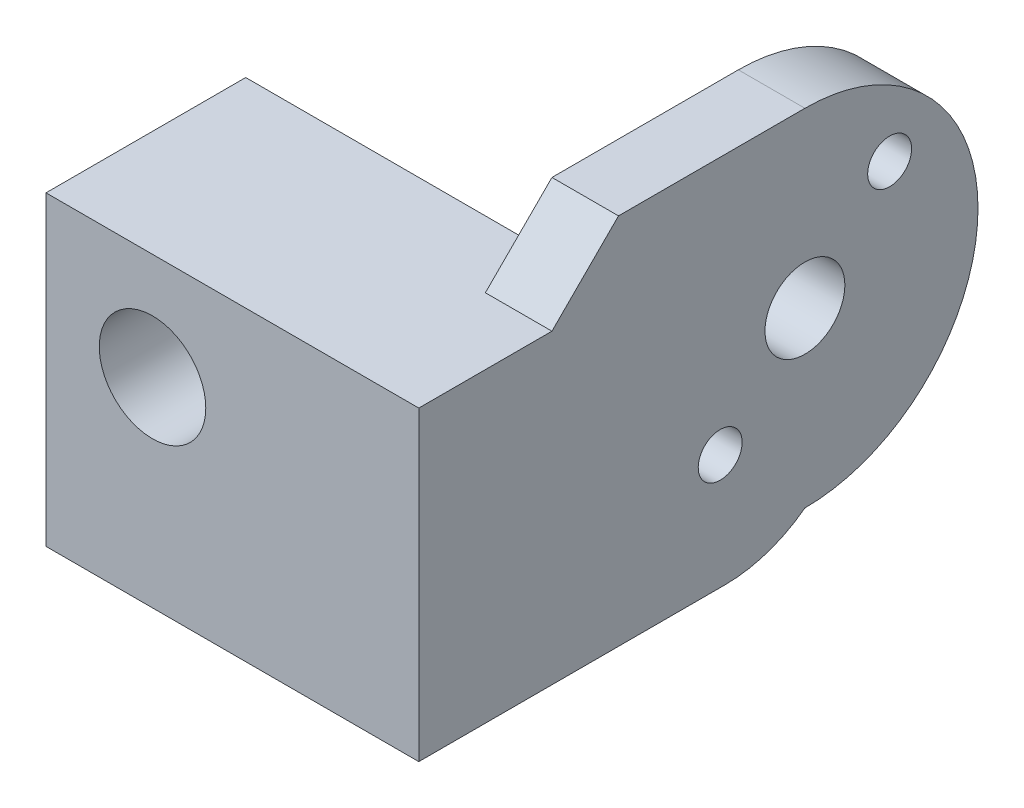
SolidWorks part; units mm, degrees
ref_plane "Alzado" through (0, 0, 0) normal (0, 0, 1) x (1, 0, 0)
ref_plane "Planta" through (0, 0, 0) normal (0, 1, 0) x (1, 0, 0)
ref_plane "Vista lateral" through (0, 0, 0) normal (1, 0, 0) x (0, 0, -1)
sketch "Croquis1" plane through (0, 0, 0) normal (0, 0, 1) x (1, 0, 0)
  line L1 (20, 8) -> (-8, 8)
  line L2 (20, 8) -> (20, -15)
  line L3 (20, -15) -> (-8, -15)
  line L4 (-8, 8) -> (-8, -15)
  circle A0 centre (0, 0) radius 4
  dimension "D1" = 8
  dimension "D2" = 8
  dimension "D3" = 8
  dimension "D4" = 15
  dimension "D5" = 20
extrude "Saliente-Extruir1" add sketch "Croquis1" along normal blind 10
sketch "Croquis2" plane through (0, 0, 0) normal (0, 0, -1) x (-1, 0, 0)
  line L4 (-20, 8) -> (-20, -15)
  line L5 (-20, -15) -> (8, -15)
  line L6 (8, -15) -> (8, 8)
  line L7 (8, 8) -> (-20, 8)
  line L8 (-20, 8) -> (-20, -15)
  line L9 (-20, -15) -> (8, -15)
  line L10 (8, -15) -> (8, 8)
  line L11 (8, 8) -> (-20, 8)
  dimension "D1" = 0
extrude "Saliente-Extruir2" add sketch "Croquis2" along normal blind 5
sketch "Croquis3" plane through (20, 0, 0) normal (1, 0, 0) x (0, 0, -1)
  line L0 (5, 8) -> (5, -15) construction
  line L1 (19, -13) -> (19, -15)
  line L2 (19, -15) -> (5, -15)
  line L3 (5, -15) -> (5, 13)
  line L4 (5, 13) -> (19, 13)
  circle A0 centre (19, 0) radius 3
  arc A1 (19, 13) -> (19, -13) centre (19, 0) cw
  dimension "D2" = 13
  dimension "D3" = 6
  dimension "D1" = 14
extrude "Saliente-Extruir3" add sketch "Croquis3" against normal blind 5
fillet "Redondeo1" radius 10 1 edges at (17.5, -15, -19)
chamfer "Chaflán1" distance 5 angle 45 1 edges at (17.5, 8, -5)
sketch "Croquis4" plane through (15, 0, 0) normal (-1, 0, 0) x (0, 0, 1)
  line L0 (-25.364, 6.364) -> (-12.636, -6.364) construction
  line L1 (-5, -15) -> (-13, -15) construction
  circle A0 centre (-19, 0) radius 3 construction
  circle A1 centre (-25.364, 6.364) radius 1.65
  circle A2 centre (-12.636, -6.364) radius 1.65
  point P4 (-19, 0)
  dimension "D3" = 3.3
  dimension "D1" = 18
  dimension "D2" = 45
extrude "Cortar-Extruir1" cut sketch "Croquis4" against normal through all
